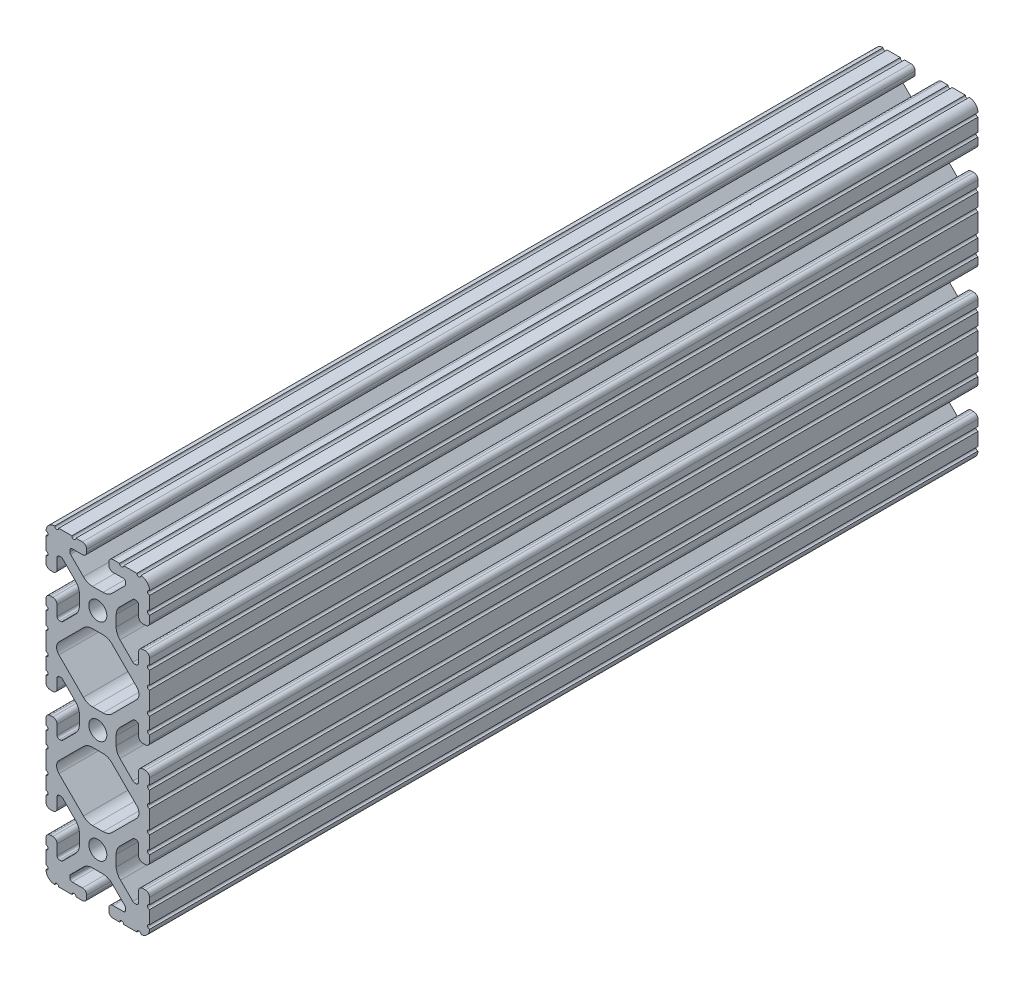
SolidWorks part; units mm, degrees
ref_plane "Front Plane" through (0, 0, 0) normal (0, 0, 1) x (1, 0, 0)
ref_plane "Top Plane" through (0, 0, 0) normal (0, 1, 0) x (1, 0, 0)
ref_plane "Right Plane" through (0, 0, 0) normal (1, 0, 0) x (0, 0, -1)
sketch "Sketch1" plane through (0, 0, 0) normal (0, 0, 1) x (1, 0, 0)
  line L0 (0, -38.1) -> (-23.9262, -38.1) construction
  line L1 (-19.05, -18.9048) -> (3.6625, -18.9048) construction
  line L2 (13.5896, -10.0195) -> (14.097, -10.0195)
  line L3 (8.1476, -4.9457) -> (12.961, -9.7591)
  line L4 (6.7564, 1.5871) -> (6.7564, -1.5871)
  line L5 (10.0266, -51.0003) -> (5.2739, -46.2476)
  line L6 (10.287, -52.2159) -> (10.287, -51.6289)
  line L7 (9.4169, -53.086) -> (5.6388, -53.086)
  line L8 (4.064, -54.6608) -> (4.064, -55.5752)
  line L9 (5.6388, -57.15) -> (8.0257, -57.15)
  line L10 (19.05, -48.387) -> (19.05, -52.4761)
  line L11 (19.05, -47.6497) -> (19.05, -48.387)
  line L12 (19.05, -43.7388) -> (19.05, -46.1257)
  line L13 (16.5608, -42.164) -> (17.4752, -42.164)
  line L14 (14.986, -47.5169) -> (14.986, -43.7388)
  line L15 (13.5478, -48.4059) -> (14.097, -48.4059)
  line L16 (8.3762, -43.6025) -> (12.9192, -48.1455)
  line L17 (-1.9153, -44.8564) -> (1.9153, -44.8564)
  line L18 (-5.2928, -7.8382) -> (-14.2815, -16.8269)
  line L19 (-14.2815, -20.9826) -> (-5.2928, -29.9713)
  line L20 (-1.9341, -31.3625) -> (1.9341, -31.3625)
  line L21 (-8.3762, -43.6025) -> (-12.9192, -48.1455)
  line L22 (6.7564, -36.2224) -> (6.7564, -40.2439)
  line L23 (1.9341, -6.447) -> (-1.9341, -6.447)
  line L24 (-28.2106, 0) -> (27.0589, 0) construction
  line L25 (0, 16.9844) -> (0, -73.9246) construction
  line L26 (12.9192, -28.0922) -> (8.1476, -32.8638)
  line L27 (14.097, -27.8319) -> (13.5478, -27.8319)
  line L28 (14.986, -32.4612) -> (14.986, -28.7209)
  line L29 (17.4752, -34.036) -> (16.5608, -34.036)
  line L30 (19.05, -30.1774) -> (19.05, -32.4612)
  line L31 (19.05, -27.813) -> (19.05, -28.6534)
  line L32 (19.05, -23.825) -> (19.05, -27.813)
  line L33 (19.05, -15.5085) -> (19.05, -22.301)
  line L34 (19.05, -12.7506) -> (19.05, -13.9845)
  line L35 (19.05, -9.5478) -> (19.05, -12.7506)
  line L36 (19.05, -5.6388) -> (19.05, -8.0238)
  line L37 (16.5608, -4.064) -> (17.4752, -4.064)
  line L38 (14.986, -9.1305) -> (14.986, -5.6388)
  line L39 (14.2815, -20.9826) -> (5.2928, -29.9713)
  line L40 (5.2928, -7.8382) -> (14.2815, -16.8269)
  line L41 (-13.5896, 10.0195) -> (-14.097, 10.0195)
  line L42 (-8.1476, 4.9457) -> (-12.961, 9.7591)
  line L43 (-10.0266, 51.0003) -> (-5.2739, 46.2476)
  line L44 (-10.287, 52.2159) -> (-10.287, 51.6289)
  line L45 (9.5497, 57.15) -> (14.3761, 57.15)
  line L46 (-9.4169, 53.086) -> (-5.6388, 53.086)
  line L47 (-4.064, 54.6608) -> (-4.064, 55.5752)
  line L48 (-5.6388, 57.15) -> (-8.0257, 57.15)
  line L49 (-14.3761, 57.15) -> (-9.5497, 57.15)
  line L50 (-19.05, 48.387) -> (-19.05, 52.4761)
  line L51 (-19.05, 47.6497) -> (-19.05, 48.387)
  line L52 (-19.05, 43.7388) -> (-19.05, 46.1257)
  line L53 (-16.5608, 42.164) -> (-17.4752, 42.164)
  line L54 (-14.986, 47.5169) -> (-14.986, 43.7388)
  line L55 (-13.5478, 48.4059) -> (-14.097, 48.4059)
  line L56 (-8.3762, 43.6025) -> (-12.9192, 48.1455)
  line L57 (-6.7564, 36.2224) -> (-6.7564, 40.2439)
  line L58 (-12.9192, 28.0922) -> (-8.1476, 32.8638)
  line L59 (-14.097, 27.8319) -> (-13.5478, 27.8319)
  line L60 (-14.986, 32.4612) -> (-14.986, 28.7209)
  line L61 (-17.4752, 34.036) -> (-16.5608, 34.036)
  line L62 (-19.05, 30.1774) -> (-19.05, 32.4612)
  line L63 (-19.05, 27.813) -> (-19.05, 28.6534)
  line L64 (-19.05, 23.825) -> (-19.05, 27.813)
  line L65 (-19.05, 15.5085) -> (-19.05, 22.301)
  line L66 (-19.05, 12.7506) -> (-19.05, 13.9845)
  line L67 (-19.05, 9.5478) -> (-19.05, 12.7506)
  line L68 (-19.05, 5.6388) -> (-19.05, 8.0238)
  line L69 (-16.5608, 4.064) -> (-17.4752, 4.064)
  line L70 (-14.986, 9.1305) -> (-14.986, 5.6388)
  line L71 (-14.2815, 20.9826) -> (-5.2928, 29.9713)
  line L72 (-5.2928, 7.8382) -> (-14.2815, 16.8269)
  line L73 (1.9341, 6.447) -> (-1.9341, 6.447)
  line L74 (-1.9341, 31.3625) -> (1.9341, 31.3625)
  line L75 (-1.9153, 44.8564) -> (1.9153, 44.8564)
  line L76 (5.2928, 7.8382) -> (14.2815, 16.8269)
  line L77 (14.2815, 20.9826) -> (5.2928, 29.9713)
  line L78 (14.986, 9.1305) -> (14.986, 5.6388)
  line L79 (16.5608, 4.064) -> (17.4752, 4.064)
  line L80 (19.05, 5.6388) -> (19.05, 8.0238)
  line L81 (19.05, 9.5478) -> (19.05, 12.7506)
  line L82 (19.05, 12.7506) -> (19.05, 13.9845)
  line L83 (19.05, 15.5085) -> (19.05, 22.301)
  line L84 (19.05, 23.825) -> (19.05, 27.813)
  line L85 (19.05, 27.813) -> (19.05, 28.6534)
  line L86 (19.05, 30.1774) -> (19.05, 32.4612)
  line L87 (17.4752, 34.036) -> (16.5608, 34.036)
  line L88 (14.986, 32.4612) -> (14.986, 28.7209)
  line L89 (14.097, 27.8319) -> (13.5478, 27.8319)
  line L90 (12.9192, 28.0922) -> (8.1476, 32.8638)
  line L91 (6.7564, 36.2224) -> (6.7564, 40.2439)
  line L92 (-13.5478, -48.4059) -> (-14.097, -48.4059)
  line L93 (8.3762, 43.6025) -> (12.9192, 48.1455)
  line L94 (13.5478, 48.4059) -> (14.097, 48.4059)
  line L95 (14.986, 47.5169) -> (14.986, 43.7388)
  line L96 (16.5608, 42.164) -> (17.4752, 42.164)
  line L97 (19.05, 43.7388) -> (19.05, 46.1257)
  line L98 (19.05, 47.6497) -> (19.05, 48.387)
  line L99 (19.05, 48.387) -> (19.05, 52.4761)
  line L100 (-14.986, -47.5169) -> (-14.986, -43.7388)
  line L101 (5.6388, 57.15) -> (8.0257, 57.15)
  line L102 (4.064, 54.6608) -> (4.064, 55.5752)
  line L103 (9.4169, 53.086) -> (5.6388, 53.086)
  line L104 (10.287, 52.2159) -> (10.287, 51.6289)
  line L105 (10.0266, 51.0003) -> (5.2739, 46.2476)
  line L106 (8.1476, 4.9457) -> (12.961, 9.7591)
  line L107 (13.5896, 10.0195) -> (14.097, 10.0195)
  line L108 (-16.5608, -42.164) -> (-17.4752, -42.164)
  line L109 (-19.05, -43.7388) -> (-19.05, -46.1257)
  line L110 (-19.05, -47.6497) -> (-19.05, -48.387)
  line L111 (-19.05, -48.387) -> (-19.05, -52.4761)
  line L112 (-14.3761, -57.15) -> (-9.5497, -57.15)
  line L113 (-5.6388, -57.15) -> (-8.0257, -57.15)
  line L114 (-4.064, -54.6608) -> (-4.064, -55.5752)
  line L115 (-9.4169, -53.086) -> (-5.6388, -53.086)
  line L116 (9.5497, -57.15) -> (14.3761, -57.15)
  line L117 (-10.287, -52.2159) -> (-10.287, -51.6289)
  line L118 (-10.0266, -51.0003) -> (-5.2739, -46.2476)
  line L160 (-14.986, -9.1305) -> (-14.986, -5.6388)
  line L161 (-16.5608, -4.064) -> (-17.4752, -4.064)
  line L162 (-19.05, -5.6388) -> (-19.05, -8.0238)
  line L163 (-19.05, -9.5478) -> (-19.05, -12.7506)
  line L164 (-19.05, -12.7506) -> (-19.05, -13.9845)
  line L165 (-19.05, -15.5085) -> (-19.05, -22.301)
  line L166 (-19.05, -23.825) -> (-19.05, -27.813)
  line L167 (-19.05, -27.813) -> (-19.05, -28.6534)
  line L168 (-19.05, -30.1774) -> (-19.05, -32.4612)
  line L169 (-17.4752, -34.036) -> (-16.5608, -34.036)
  line L170 (-14.986, -32.4612) -> (-14.986, -28.7209)
  line L171 (-14.097, -27.8319) -> (-13.5478, -27.8319)
  line L172 (-12.9192, -28.0922) -> (-8.1476, -32.8638)
  line L173 (-6.7564, -36.2224) -> (-6.7564, -40.2439)
  line L281 (-6.7564, 1.5871) -> (-6.7564, -1.5871)
  line L282 (-8.1476, -4.9457) -> (-12.961, -9.7591)
  line L283 (-13.5896, -10.0195) -> (-14.097, -10.0195)
  arc A0 (13.5896, -10.0195) -> (12.961, -9.7591) centre (13.5896, -9.1305) cw
  arc A1 (8.1476, -4.9457) -> (6.7564, -1.5871) centre (11.5062, -1.5871) cw
  arc A2 (-15.8265, -57.1499) -> (-14.3761, -57.15) centre (-15.1013, -57.1141) cw
  circle A3 centre (0, -38.1) radius 3.3274
  circle A4 centre (0, 0) radius 3.3274
  arc A5 (-9.5497, -57.15) -> (-8.0257, -57.15) centre (-8.7877, -57.15) cw
  arc A6 (1.9153, -44.8564) -> (5.2739, -46.2476) centre (1.9153, -49.6062) cw
  arc A7 (10.0266, -51.0003) -> (10.287, -51.6289) centre (9.398, -51.6289) cw
  arc A8 (10.287, -52.2159) -> (9.4169, -53.086) centre (9.4169, -52.2159) cw
  arc A9 (5.6388, -53.086) -> (4.064, -54.6608) centre (5.6388, -54.6608) ccw
  arc A10 (4.064, -55.5752) -> (5.6388, -57.15) centre (5.6388, -55.5752) ccw
  arc A11 (19.0499, -53.9265) -> (15.8265, -57.1499) centre (15.8046, -53.9046) cw
  arc A12 (19.0499, -53.9265) -> (19.05, -52.4761) centre (19.0141, -53.2013) cw
  arc A13 (19.05, -47.6497) -> (19.05, -46.1257) centre (19.05, -46.8877) cw
  arc A14 (17.4752, -42.164) -> (19.05, -43.7388) centre (17.4752, -43.7388) cw
  arc A15 (14.986, -43.7388) -> (16.5608, -42.164) centre (16.5608, -43.7388) cw
  arc A16 (14.986, -47.5169) -> (14.097, -48.4059) centre (14.097, -47.5169) cw
  arc A17 (13.5478, -48.4059) -> (12.9192, -48.1455) centre (13.5478, -47.5169) cw
  arc A18 (9.5497, -57.15) -> (8.0257, -57.15) centre (8.7877, -57.15) ccw
  arc A19 (6.7564, -36.2224) -> (8.1476, -32.8638) centre (11.5062, -36.2224) cw
  arc A20 (12.9192, -28.0922) -> (13.5478, -27.8319) centre (13.5478, -28.7209) cw
  arc A21 (14.097, -27.8319) -> (14.986, -28.7209) centre (14.097, -28.7209) cw
  arc A22 (16.5608, -34.036) -> (14.986, -32.4612) centre (16.5608, -32.4612) cw
  arc A23 (19.05, -32.4612) -> (17.4752, -34.036) centre (17.4752, -32.4612) cw
  arc A24 (-14.2815, -16.8269) -> (-14.2815, -20.9826) centre (-12.2036, -18.9048) ccw
  arc A25 (-5.2928, -29.9713) -> (-1.9341, -31.3625) centre (-1.9341, -26.6127) ccw
  arc A26 (19.05, -30.1774) -> (19.05, -28.6534) centre (19.05, -29.4154) cw
  arc A27 (19.05, -23.825) -> (19.05, -22.301) centre (19.05, -23.063) cw
  arc A28 (19.05, -15.5085) -> (19.05, -13.9845) centre (19.05, -14.7465) cw
  arc A29 (-1.9341, -6.447) -> (-5.2928, -7.8382) centre (-1.9341, -11.1968) ccw
  arc A30 (19.05, -9.5478) -> (19.05, -8.0238) centre (19.05, -8.7858) cw
  arc A31 (17.4752, -4.064) -> (19.05, -5.6388) centre (17.4752, -5.6388) cw
  arc A32 (14.986, -5.6388) -> (16.5608, -4.064) centre (16.5608, -5.6388) cw
  arc A33 (14.986, -9.1305) -> (14.097, -10.0195) centre (14.097, -9.1305) cw
  arc A34 (1.9341, -6.447) -> (5.2928, -7.8382) centre (1.9341, -11.1968) cw
  arc A35 (5.2928, -29.9713) -> (1.9341, -31.3625) centre (1.9341, -26.6127) cw
  arc A36 (14.2815, -16.8269) -> (14.2815, -20.9826) centre (12.2036, -18.9048) cw
  arc A37 (-13.5896, 10.0195) -> (-12.961, 9.7591) centre (-13.5896, 9.1305) cw
  arc A38 (-8.1476, 4.9457) -> (-6.7564, 1.5871) centre (-11.5062, 1.5871) cw
  arc A39 (-1.9153, 44.8564) -> (-5.2739, 46.2476) centre (-1.9153, 49.6062) cw
  arc A40 (-10.0266, 51.0003) -> (-10.287, 51.6289) centre (-9.398, 51.6289) cw
  arc A41 (-10.287, 52.2159) -> (-9.4169, 53.086) centre (-9.4169, 52.2159) cw
  arc A42 (15.8265, 57.1499) -> (14.3761, 57.15) centre (15.1013, 57.1141) cw
  arc A43 (-5.6388, 53.086) -> (-4.064, 54.6608) centre (-5.6388, 54.6608) ccw
  arc A44 (-4.064, 55.5752) -> (-5.6388, 57.15) centre (-5.6388, 55.5752) ccw
  arc A45 (8.3762, -43.6025) -> (6.7564, -40.2439) centre (11.5012, -40.0255) cw
  arc A46 (-19.0499, 53.9265) -> (-15.8265, 57.1499) centre (-15.8046, 53.9046) cw
  arc A47 (-19.0499, 53.9265) -> (-19.05, 52.4761) centre (-19.0141, 53.2013) cw
  arc A48 (-19.05, 47.6497) -> (-19.05, 46.1257) centre (-19.05, 46.8877) cw
  arc A49 (-17.4752, 42.164) -> (-19.05, 43.7388) centre (-17.4752, 43.7388) cw
  arc A50 (-14.986, 43.7388) -> (-16.5608, 42.164) centre (-16.5608, 43.7388) cw
  arc A51 (-14.986, 47.5169) -> (-14.097, 48.4059) centre (-14.097, 47.5169) cw
  arc A52 (-13.5478, 48.4059) -> (-12.9192, 48.1455) centre (-13.5478, 47.5169) cw
  arc A53 (-8.3762, 43.6025) -> (-6.7564, 40.2439) centre (-11.5012, 40.0255) cw
  arc A54 (-6.7564, 36.2224) -> (-8.1476, 32.8638) centre (-11.5062, 36.2224) cw
  arc A55 (-12.9192, 28.0922) -> (-13.5478, 27.8319) centre (-13.5478, 28.7209) cw
  arc A56 (-14.097, 27.8319) -> (-14.986, 28.7209) centre (-14.097, 28.7209) cw
  arc A57 (-16.5608, 34.036) -> (-14.986, 32.4612) centre (-16.5608, 32.4612) cw
  arc A58 (-19.05, 32.4612) -> (-17.4752, 34.036) centre (-17.4752, 32.4612) cw
  arc A59 (-19.05, 30.1774) -> (-19.05, 28.6534) centre (-19.05, 29.4154) cw
  arc A60 (-19.05, 23.825) -> (-19.05, 22.301) centre (-19.05, 23.063) cw
  arc A61 (-19.05, 15.5085) -> (-19.05, 13.9845) centre (-19.05, 14.7465) cw
  arc A62 (-19.05, 9.5478) -> (-19.05, 8.0238) centre (-19.05, 8.7858) cw
  arc A63 (-17.4752, 4.064) -> (-19.05, 5.6388) centre (-17.4752, 5.6388) cw
  arc A64 (-14.986, 5.6388) -> (-16.5608, 4.064) centre (-16.5608, 5.6388) cw
  arc A65 (-14.986, 9.1305) -> (-14.097, 10.0195) centre (-14.097, 9.1305) cw
  arc A66 (-1.9341, 6.447) -> (-5.2928, 7.8382) centre (-1.9341, 11.1968) cw
  arc A67 (-5.2928, 29.9713) -> (-1.9341, 31.3625) centre (-1.9341, 26.6127) cw
  arc A68 (-14.2815, 16.8269) -> (-14.2815, 20.9826) centre (-12.2036, 18.9048) cw
  arc A69 (14.2815, 16.8269) -> (14.2815, 20.9826) centre (12.2036, 18.9048) ccw
  arc A70 (5.2928, 29.9713) -> (1.9341, 31.3625) centre (1.9341, 26.6127) ccw
  arc A71 (1.9341, 6.447) -> (5.2928, 7.8382) centre (1.9341, 11.1968) ccw
  arc A72 (14.986, 9.1305) -> (14.097, 10.0195) centre (14.097, 9.1305) ccw
  arc A73 (14.986, 5.6388) -> (16.5608, 4.064) centre (16.5608, 5.6388) ccw
  arc A74 (17.4752, 4.064) -> (19.05, 5.6388) centre (17.4752, 5.6388) ccw
  arc A75 (19.05, 9.5478) -> (19.05, 8.0238) centre (19.05, 8.7858) ccw
  arc A76 (19.05, 15.5085) -> (19.05, 13.9845) centre (19.05, 14.7465) ccw
  arc A77 (19.05, 23.825) -> (19.05, 22.301) centre (19.05, 23.063) ccw
  arc A78 (19.05, 30.1774) -> (19.05, 28.6534) centre (19.05, 29.4154) ccw
  arc A79 (19.05, 32.4612) -> (17.4752, 34.036) centre (17.4752, 32.4612) ccw
  arc A80 (16.5608, 34.036) -> (14.986, 32.4612) centre (16.5608, 32.4612) ccw
  arc A81 (14.097, 27.8319) -> (14.986, 28.7209) centre (14.097, 28.7209) ccw
  arc A82 (12.9192, 28.0922) -> (13.5478, 27.8319) centre (13.5478, 28.7209) ccw
  arc A83 (6.7564, 36.2224) -> (8.1476, 32.8638) centre (11.5062, 36.2224) ccw
  arc A84 (8.3762, 43.6025) -> (6.7564, 40.2439) centre (11.5012, 40.0255) ccw
  arc A85 (9.5497, 57.15) -> (8.0257, 57.15) centre (8.7877, 57.15) cw
  arc A86 (13.5478, 48.4059) -> (12.9192, 48.1455) centre (13.5478, 47.5169) ccw
  arc A87 (14.986, 47.5169) -> (14.097, 48.4059) centre (14.097, 47.5169) ccw
  arc A88 (14.986, 43.7388) -> (16.5608, 42.164) centre (16.5608, 43.7388) ccw
  arc A89 (17.4752, 42.164) -> (19.05, 43.7388) centre (17.4752, 43.7388) ccw
  arc A90 (19.05, 47.6497) -> (19.05, 46.1257) centre (19.05, 46.8877) ccw
  arc A91 (19.0499, 53.9265) -> (19.05, 52.4761) centre (19.0141, 53.2013) ccw
  arc A92 (19.0499, 53.9265) -> (15.8265, 57.1499) centre (15.8046, 53.9046) ccw
  arc A93 (-8.3762, -43.6025) -> (-6.7564, -40.2439) centre (-11.5012, -40.0255) ccw
  arc A94 (4.064, 55.5752) -> (5.6388, 57.15) centre (5.6388, 55.5752) cw
  arc A95 (5.6388, 53.086) -> (4.064, 54.6608) centre (5.6388, 54.6608) cw
  arc A96 (10.287, 52.2159) -> (9.4169, 53.086) centre (9.4169, 52.2159) ccw
  arc A97 (10.0266, 51.0003) -> (10.287, 51.6289) centre (9.398, 51.6289) ccw
  arc A98 (1.9153, 44.8564) -> (5.2739, 46.2476) centre (1.9153, 49.6062) ccw
  arc A99 (8.1476, 4.9457) -> (6.7564, 1.5871) centre (11.5062, 1.5871) ccw
  arc A100 (13.5896, 10.0195) -> (12.961, 9.7591) centre (13.5896, 9.1305) ccw
  circle A101 centre (0, 38.1) radius 3.3274
  arc A102 (-9.5497, 57.15) -> (-8.0257, 57.15) centre (-8.7877, 57.15) ccw
  arc A103 (-15.8265, 57.1499) -> (-14.3761, 57.15) centre (-15.1013, 57.1141) ccw
  arc A104 (-13.5478, -48.4059) -> (-12.9192, -48.1455) centre (-13.5478, -47.5169) ccw
  arc A105 (-14.986, -47.5169) -> (-14.097, -48.4059) centre (-14.097, -47.5169) ccw
  arc A106 (-14.986, -43.7388) -> (-16.5608, -42.164) centre (-16.5608, -43.7388) ccw
  arc A107 (-17.4752, -42.164) -> (-19.05, -43.7388) centre (-17.4752, -43.7388) ccw
  arc A108 (-19.05, -47.6497) -> (-19.05, -46.1257) centre (-19.05, -46.8877) ccw
  arc A109 (-19.0499, -53.9265) -> (-19.05, -52.4761) centre (-19.0141, -53.2013) ccw
  arc A110 (-19.0499, -53.9265) -> (-15.8265, -57.1499) centre (-15.8046, -53.9046) ccw
  arc A111 (-4.064, -55.5752) -> (-5.6388, -57.15) centre (-5.6388, -55.5752) cw
  arc A112 (-5.6388, -53.086) -> (-4.064, -54.6608) centre (-5.6388, -54.6608) cw
  arc A113 (15.8265, -57.1499) -> (14.3761, -57.15) centre (15.1013, -57.1141) ccw
  arc A114 (-10.287, -52.2159) -> (-9.4169, -53.086) centre (-9.4169, -52.2159) ccw
  arc A115 (-10.0266, -51.0003) -> (-10.287, -51.6289) centre (-9.398, -51.6289) ccw
  arc A116 (-1.9153, -44.8564) -> (-5.2739, -46.2476) centre (-1.9153, -49.6062) ccw
  arc A161 (-14.986, -9.1305) -> (-14.097, -10.0195) centre (-14.097, -9.1305) ccw
  arc A162 (-14.986, -5.6388) -> (-16.5608, -4.064) centre (-16.5608, -5.6388) ccw
  arc A163 (-17.4752, -4.064) -> (-19.05, -5.6388) centre (-17.4752, -5.6388) ccw
  arc A164 (-19.05, -9.5478) -> (-19.05, -8.0238) centre (-19.05, -8.7858) ccw
  arc A165 (-19.05, -15.5085) -> (-19.05, -13.9845) centre (-19.05, -14.7465) ccw
  arc A166 (-19.05, -23.825) -> (-19.05, -22.301) centre (-19.05, -23.063) ccw
  arc A167 (-19.05, -30.1774) -> (-19.05, -28.6534) centre (-19.05, -29.4154) ccw
  arc A168 (-19.05, -32.4612) -> (-17.4752, -34.036) centre (-17.4752, -32.4612) ccw
  arc A169 (-16.5608, -34.036) -> (-14.986, -32.4612) centre (-16.5608, -32.4612) ccw
  arc A170 (-14.097, -27.8319) -> (-14.986, -28.7209) centre (-14.097, -28.7209) ccw
  arc A171 (-12.9192, -28.0922) -> (-13.5478, -27.8319) centre (-13.5478, -28.7209) ccw
  arc A172 (-6.7564, -36.2224) -> (-8.1476, -32.8638) centre (-11.5062, -36.2224) ccw
  arc A275 (-8.1476, -4.9457) -> (-6.7564, -1.5871) centre (-11.5062, -1.5871) ccw
  arc A276 (-13.5896, -10.0195) -> (-12.961, -9.7591) centre (-13.5896, -9.1305) ccw
  point P38 (0, -31.3625)
  point P181 (0, -6.447)
  point P274 (-6.7564, 0)
  point P278 (0, 6.447)
  point P279 (0, 44.8564)
  point P280 (0, 31.3625)
  point P377 (0, -44.8564)
  point P410 (6.7564, 0)
  dimension "D1" = 6.6548
  dimension "D2" = 114.3
  dimension "D3" = 12.2936
  dimension "D4" = 38.1
  dimension "D5" = 19.05
  dimension "D6" = 4.064
  dimension "D7" = 4.064
  dimension "D10" = 8.128
  dimension "D11" = 20.574
extrude "Extrude1" add sketch "Sketch1" against normal blind 304.8
